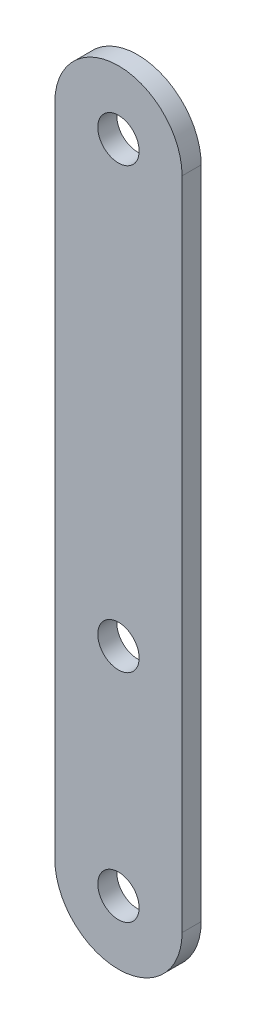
SolidWorks part; units mm, degrees
ref_plane "Front Plane" through (0, 0, 0) normal (0, 0, 1) x (1, 0, 0)
ref_plane "Top Plane" through (0, 0, 0) normal (0, 1, 0) x (1, 0, 0)
ref_plane "Right Plane" through (0, 0, 0) normal (1, 0, 0) x (0, 0, -1)
sketch "Sketch1" plane through (0, 0, 0) normal (0, 0, 1) x (1, 0, 0)
  line L0 (0, 0) -> (0, 103) construction
  line L1 (10, 0) -> (10, 103)
  line L2 (-10, 0) -> (-10, 103)
  circle A0 centre (0, 103) radius 3.25
  circle A1 centre (0, 0) radius 3.25
  circle A2 centre (0, 34) radius 3.25
  arc A3 (10, 0) -> (-10, 0) centre (0, 0) cw
  arc A4 (10, 103) -> (-10, 103) centre (0, 103) ccw
  dimension "D2" = 6.5
  dimension "D3" = 69
  dimension "D1" = 103
  dimension "D4" = 10
  dimension "D5" = 10
extrude "Extrude1" add sketch "Sketch1" along normal blind 3
